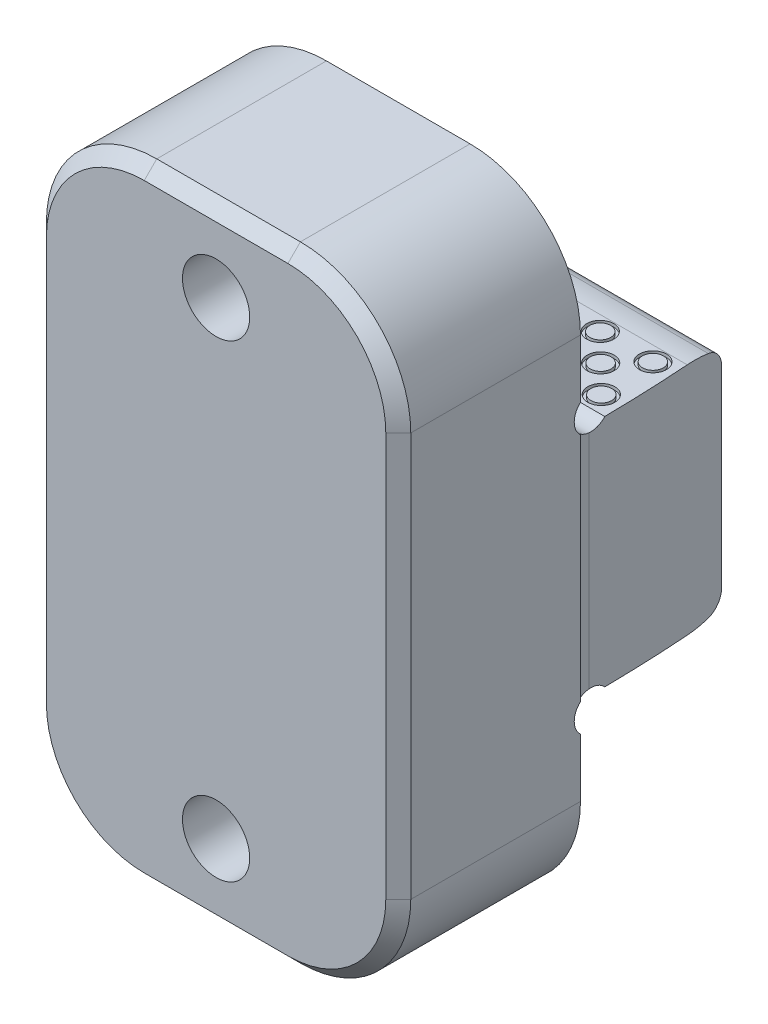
SolidWorks part; units mm, degrees
ref_plane "Front Plane" through (0, 0, 0) normal (0, 0, 1) x (1, 0, 0)
ref_plane "Top Plane" through (0, 0, 0) normal (0, 1, 0) x (1, 0, 0)
ref_plane "Right Plane" through (0, 0, 0) normal (1, 0, 0) x (0, 0, -1)
sketch "Sketch3" plane through (0, 0, 0) normal (1, 0, 0) x (0, 0, -1)
  line L0 (0, 24.4475) -> (0, -24.4475) construction
  line L1 (-22.225, -38.1) -> (0, -38.1)
  line L2 (-22.225, -38.1) -> (-22.225, 38.1)
  line L3 (-22.225, 38.1) -> (0, 38.1)
  line L4 (18.288, -14.285) -> (18.288, 14.285)
  line L6 (0, -38.1) -> (0, -14.285)
  line L7 (0, -14.285) -> (18.288, -14.285)
  line L8 (0, 38.1) -> (0, 14.285)
  line L9 (0, 14.285) -> (18.288, 14.285)
  line L10 (0, 0) -> (50000, 0) construction
  dimension "D1" = 40.513
  dimension "D2" = 22.225
  dimension "D3" = 76.2
  dimension "D4" = 28.5699
extrude "Extrude1" add sketch "Sketch3" along normal mid plane 44.45
sketch "Sketch7" plane through (22.225, 0, 0) normal (1, 0, 0) x (0, 0, -1)
  line L1 (0, -14.5526) -> (21.9683, -14.5526)
  line L2 (0, -14.5526) -> (0, 17.1683)
  line L3 (0, 17.1683) -> (21.9683, 17.1683)
  line L4 (21.9683, -14.5526) -> (21.9683, 17.1683)
  line L5 (0, -38.1) -> (0, -14.285) construction
extrude "Cut-Extrude3" cut sketch "Sketch7" against normal blind 0.254
mirror "Mirror2" about plane through (0, 0, 0) normal (1, 0, 0) of "Cut-Extrude3"
sketch "Sketch8" plane through (22.225, 0, 0) normal (1, 0, 0) x (0, 0, -1)
  line L0 (0, 0) -> (50000, 0) construction
  line L1 (0, -38.1) -> (0, 38.1) construction
  line L2 (0, 14.285) -> (18.288, 14.285) construction
  circle A0 centre (1.524, 15.809) radius 2.286
  circle A1 centre (1.524, -15.809) radius 2.286
  dimension "D1" = 2.286
  dimension "D2" = 0.762
  dimension "D3" = 0.762
extrude "Cut-Extrude4" cut sketch "Sketch8" against normal through all
sketch "Sketch9" plane through (22.225, 0, 0) normal (1, 0, 0) x (0, 0, -1)
  line L0 (3.2279, 14.285) -> (18.288, 14.285) construction
  line L1 (18.288, 14.285) -> (18.288, -14.285) construction
  line L2 (0, 0) -> (50000, 0) construction
  line L3 (18.288, 11.745) -> (20.066, 11.745)
  line L4 (13.716, 14.285) -> (13.716, 18.095)
  line L5 (13.716, 18.095) -> (20.066, 18.095)
  line L6 (20.066, 11.745) -> (20.066, 18.095)
  line L7 (20.066, -11.745) -> (20.066, -18.095)
  line L8 (13.716, -18.095) -> (20.066, -18.095)
  line L9 (13.716, -14.285) -> (13.716, -18.095)
  line L10 (18.288, -11.745) -> (20.066, -11.745)
  arc A0 (13.716, 14.285) -> (16.5038, 13.9752) centre (13.716, 1.585) cw
  arc A1 (16.5038, 13.9752) -> (18.288, 11.745) centre (16.002, 11.745) cw
  arc A2 (16.5038, -13.9752) -> (18.288, -11.745) centre (16.002, -11.745) ccw
  arc A3 (13.716, -14.285) -> (16.5038, -13.9752) centre (13.716, -1.585) ccw
  dimension "D1" = 2.286
  dimension "D2" = 12.7
  dimension "D3" = 4.572
  dimension "D4" = 6.35
  dimension "D5" = 6.35
extrude "Cut-Extrude5" cut sketch "Sketch9" against normal through all
sketch "Sketch13" plane through (0, 38.1, 0) normal (0, 1, 0) x (1, 0, 0)
  line L0 (21.971, 3.2279) -> (21.971, 13.716) construction
  line L2 (20.1474, 26.67) -> (32.8474, 26.67)
  line L4 (21.971, 1.27) -> (32.8474, 1.27)
  line L5 (32.8474, 26.67) -> (32.8474, 1.27)
  arc A0 (20.1474, 26.67) -> (21.971, 1.27) centre (-155.829, 1.27) cw
  dimension "D1" = 177.8
  dimension "D2" = 1.27
  dimension "D3" = 25.4
  dimension "D4" = 12.7
extrude "Cut-Extrude6" cut sketch "Sketch13" against normal through all
sketch "Sketch15" plane through (0, 14.285, 0) normal (0, 1, 0) x (1, 0, 0)
  line L0 (-22.225, 13.716) -> (-22.225, -0.1799) construction
  line L1 (22.225, -22.225) -> (-22.225, -22.225) construction
  circle A0 centre (-13.0048, 11.938) radius 1.651
  circle A1 centre (-13.0048, 11.938) radius 1.27
  circle A2 centre (-6.5786, 11.938) radius 1.651
  circle A3 centre (-6.5786, 11.938) radius 1.27
  circle A4 centre (-19.431, 11.938) radius 1.651
  circle A5 centre (-19.431, 11.938) radius 1.27
  circle A6 centre (-0.1524, 11.938) radius 1.651
  circle A7 centre (-0.1524, 11.938) radius 1.27
  circle A8 centre (6.2738, 11.938) radius 1.651
  circle A9 centre (6.2738, 11.938) radius 1.27
  circle A10 centre (12.7, 11.938) radius 1.651
  circle A11 centre (12.7, 11.938) radius 1.27
  circle A12 centre (19.1262, 11.938) radius 1.651
  circle A13 centre (19.1262, 11.938) radius 1.27
  circle A14 centre (-9.7536, 8.636) radius 1.27
  circle A15 centre (-9.7536, 8.636) radius 1.651
  circle A16 centre (-3.302, 8.636) radius 1.27
  circle A17 centre (-3.302, 8.636) radius 1.651
  circle A18 centre (-16.2052, 8.636) radius 1.27
  circle A19 centre (-16.2052, 8.636) radius 1.651
  circle A20 centre (3.1496, 8.636) radius 1.27
  circle A21 centre (3.1496, 8.636) radius 1.651
  circle A22 centre (9.6012, 8.636) radius 1.27
  circle A23 centre (9.6012, 8.636) radius 1.651
  circle A24 centre (16.0528, 8.636) radius 1.27
  circle A25 centre (16.0528, 8.636) radius 1.651
  circle A26 centre (-12.954, 5.334) radius 1.27
  circle A27 centre (-12.954, 5.334) radius 1.651
  circle A28 centre (-6.477, 5.334) radius 1.27
  circle A29 centre (-6.477, 5.334) radius 1.651
  circle A30 centre (-19.431, 5.334) radius 1.27
  circle A31 centre (-19.431, 5.334) radius 1.651
  circle A32 centre (0, 5.334) radius 1.27
  circle A33 centre (0, 5.334) radius 1.651
  circle A34 centre (6.477, 5.334) radius 1.27
  circle A35 centre (6.477, 5.334) radius 1.651
  circle A36 centre (12.954, 5.334) radius 1.27
  circle A37 centre (12.954, 5.334) radius 1.651
  circle A38 centre (19.431, 5.334) radius 1.27
  circle A39 centre (19.431, 5.334) radius 1.651
  dimension "D1" = 2.794
  dimension "D2" = 6.0198
  dimension "D12" = 6.4262
  dimension "D7" = 3.302
  dimension "D8" = 2.54
  dimension "D3" = 34.163
  dimension "D4" = 3.302
  dimension "D5" = 3.302
  dimension "D6" = 6.4262
  dimension "D9" = 6.4262
  dimension "D10" = 6.4262
  dimension "D11" = 6.4262
  dimension "D13" = 6.4262
  dimension "D14" = 6.4516
  dimension "D15" = 6.4516
  dimension "D16" = 6.4516
  dimension "D17" = 6.4516
  dimension "D18" = 6.4516
  dimension "D19" = 6.477
  dimension "D20" = 6.477
  dimension "D21" = 6.477
  dimension "D22" = 6.477
  dimension "D23" = 6.477
  dimension "D24" = 6.477
extrude "Cut-Extrude7" cut sketch "Sketch15" against normal blind 0.381
mirror "Mirror1" about plane through (0, 0, 0) normal (0, 1, 0) of "Cut-Extrude7"
hole_wizard "5/16\"-18 CBORE" positions "Sketch11" profile "Sketch10" counterbore size "5/16" standard "Ansi Inch"
sketch "Sketch11" plane through (0, 0, 0) normal (0, 0, -1) x (-1, 0, 0)
  line L0 (0, 0) -> (0, 50000) construction
  line L1 (0, 0) -> (50000, 0) construction
  point P0 (0, 28.575)
  point P10 (0, -28.575)
  dimension "D1" = 57.15
sketch "Sketch10" plane through (0, 28.575, 0) normal (1, 0, 0) x (0, 1, 0)
  line L0 (0, 0) -> (0, 22.225)
  line L1 (0, 22.225) -> (3.81, 22.225)
  line L3 (3.81, 22.225) -> (3.81, 8.7325)
  line L4 (3.81, 8.7325) -> (6.7475, 8.7325)
  line L5 (6.7475, 8.7325) -> (6.7475, 0)
  line L7 (6.7475, 0) -> (0, 0)
  line L11 (0, -6.35) -> (0, 107.95) construction
  dimension "Thru Hole Dia." = 7.62
  dimension "Thru Hole Depth" = 22.225
  dimension "C'Bore Dia." = 13.495
  dimension "C'Bore Depth" = 8.7325
hole_wizard "3/8-16 Tapped Hole1" positions "Sketch17" profile "Sketch16" tap size "3/8-16" standard "Ansi Inch"
sketch "Sketch17" plane through (0, 0, 8.7325) normal (0, 0, -1) x (-1, 0, 0)
  point P0 (0, 28.575)
  point P1 (0, -28.575)
sketch "Sketch16" plane through (0, 28.575, 8.7325) normal (1, 0, 0) x (0, 1, 0)
  line L0 (0, 0) -> (0, 13.4925)
  line L1 (0, 13.4925) -> (4.1021, 13.4925)
  line L2 (4.1021, 13.4925) -> (4.1021, 0)
  line L5 (4.1021, 0) -> (0, 0)
  line L11 (0, -6.35) -> (0, 107.95) construction
  dimension "Thread Major Dia." = 8.2042
  dimension "Thru Tap Drill Depth" = 13.4925
fillet "Fillet1" radius 13.462 4 edges at (-22.225, 38.1, 11.1125) (-22.225, -38.1, 11.1125) (22.225, -38.1, 11.1125) (22.225, 38.1, 11.1125)
chamfer "Chamfer1" distance 1.524 angle 45 8 edges at (0, 38.1, 22.225) (-18.2821, 34.1571, 22.225) (-22.225, 0, 22.225) (0, -38.1, 22.225) (-18.2821, -34.1571, 22.225) (22.225, 0, 22.225) (18.2821, 34.1571, 22.225) (18.2821, -34.1571, 22.225)
